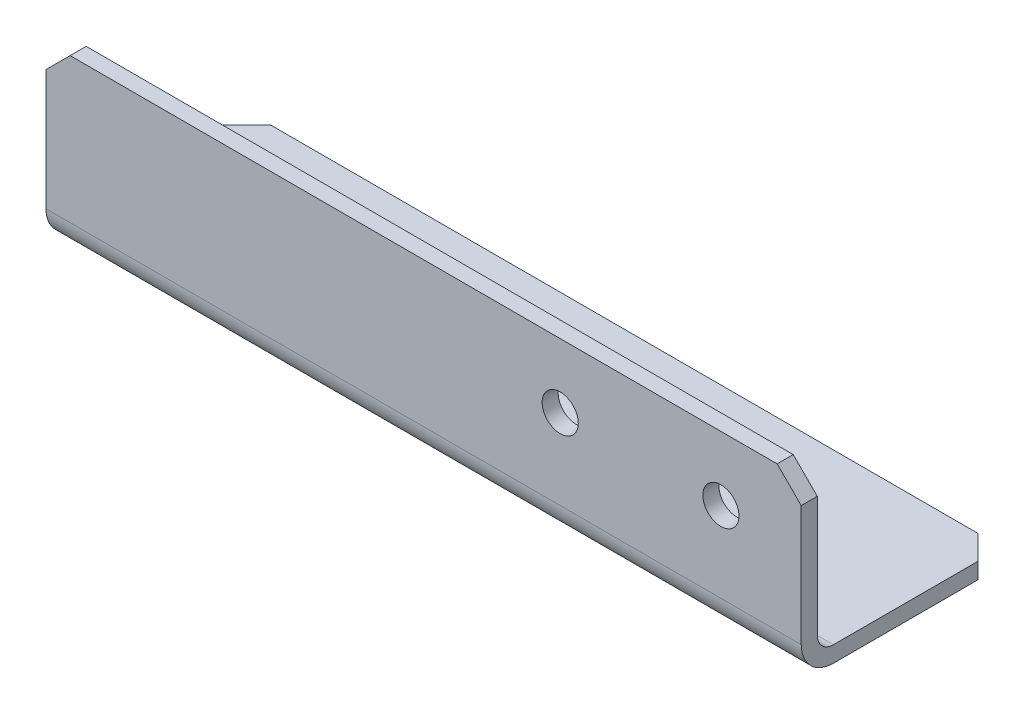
SolidWorks part; units mm, degrees
ref_plane "Спереди" through (0, 0, 0) normal (0, 0, 1) x (1, 0, 0)
ref_plane "Сверху" through (0, 0, 0) normal (0, 1, 0) x (1, 0, 0)
ref_plane "Справа" through (0, 0, 0) normal (1, 0, 0) x (0, 0, -1)
sketch "Эскиз1" plane through (0, 0, 0) normal (1, 0, 0) x (0, 0, -1)
  line L0 (4, 0) -> (25, 0)
  line L1 (25, 0) -> (25, 2)
  line L2 (25, 2) -> (4, 2)
  line L3 (2, 4) -> (2, 22)
  line L4 (2, 22) -> (0, 22)
  line L5 (0, 22) -> (0, 4)
  arc A0 (4, 2) -> (2, 4) centre (4, 4) cw
  arc A1 (4, 0) -> (0, 4) centre (4, 4) cw
  point P11 (0, 0)
  dimension "D5" = 2
  dimension "D6" = 4
  dimension "D1" = 2
  dimension "D2" = 25
  dimension "D3" = 22
  dimension "D4" = 2
extrude "Бобышка-Вытянуть1" add sketch "Эскиз1" along normal blind 94
sketch "Эскиз2" plane through (0, 0, -2) normal (0, 0, -1) x (-1, 0, 0)
  line L0 (-94, 22) -> (0, 22) construction
  line L1 (-94, 4) -> (-94, 22) construction
  circle A0 centre (-84, 14) radius 2.25
  circle A1 centre (-64, 14) radius 2.25
  dimension "D1" = 4.5
  dimension "D2" = 4.5
  dimension "D3" = 8
  dimension "D4" = 10
  dimension "D5" = 8
  dimension "D6" = 20
extrude "Вырез-Вытянуть1" cut sketch "Эскиз2" against normal blind 10
chamfer "Фаска1" distance 3 angle 45 4 edges at (94, 1, -25) (0, 1, -25) (94, 22, -1) (0, 22, -1)
